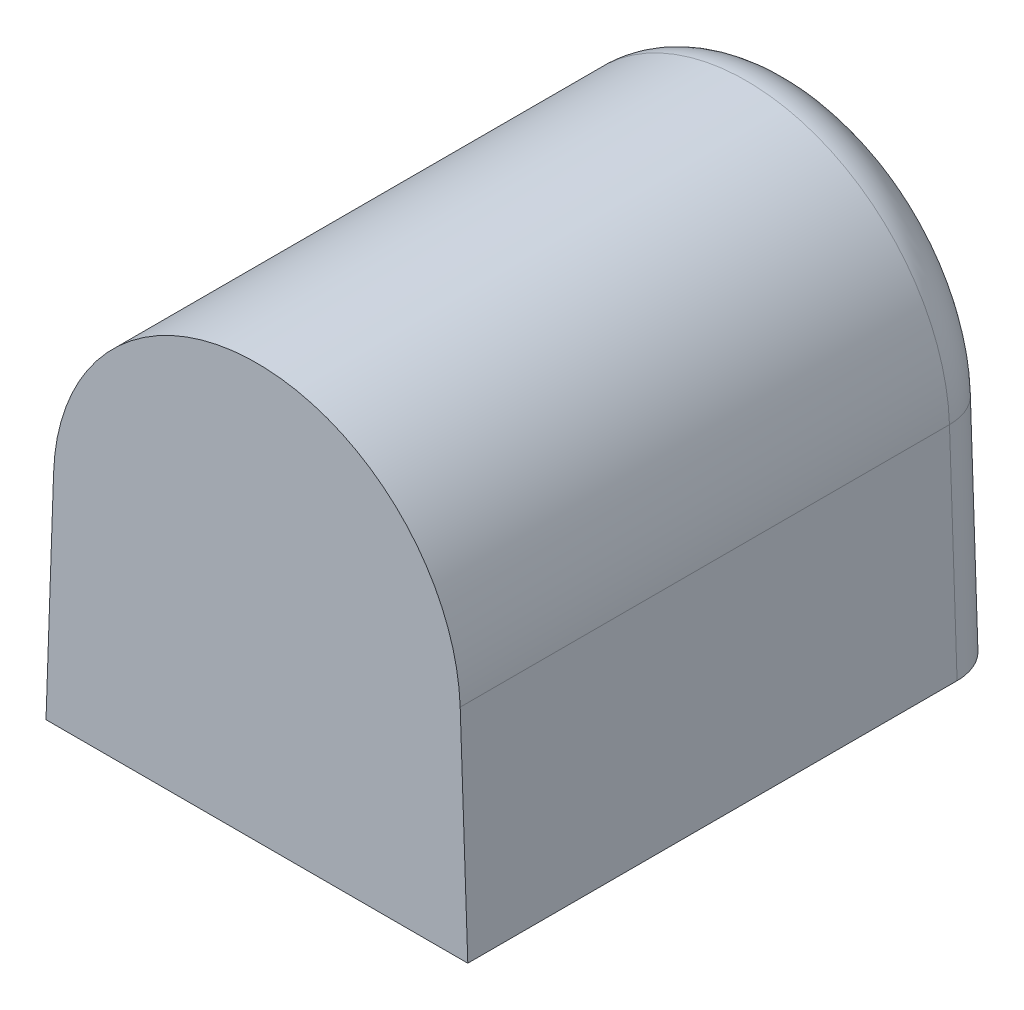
SolidWorks part; units mm, degrees
ref_plane "Front Plane" through (0, 0, 0) normal (0, 0, 1) x (1, 0, 0)
ref_plane "Top Plane" through (0, 0, 0) normal (0, 1, 0) x (1, 0, 0)
ref_plane "Right Plane" through (0, 0, 0) normal (1, 0, 0) x (0, 0, -1)
sketch "Sketch1" plane through (0, 0, 0) normal (0, 0, 1) x (1, 0, 0)
  line L0 (0, 0) -> (0, 12.5) construction
  line L1 (-12.5, 0) -> (12.5, 0)
  line L2 (12.5, 0) -> (12.0488, 12.9208)
  line L3 (-12.5, 0) -> (-12.0488, 12.9208)
  arc A0 (-12.0488, 12.9208) -> (12.0488, 12.9208) centre (0, 12.5) cw
  dimension "D1" = 12.5
  dimension "D2" = 2
  dimension "D3" = 25
extrude "Boss-Extrude1" add sketch "Sketch1" against normal blind 32 contours L1 L2 A0 L3
fillet "Fillet1" radius 3 3 edges at (-12.2744, 6.4604, -32) (12.2744, 6.4604, -32) (0, 24.5561, -32)
